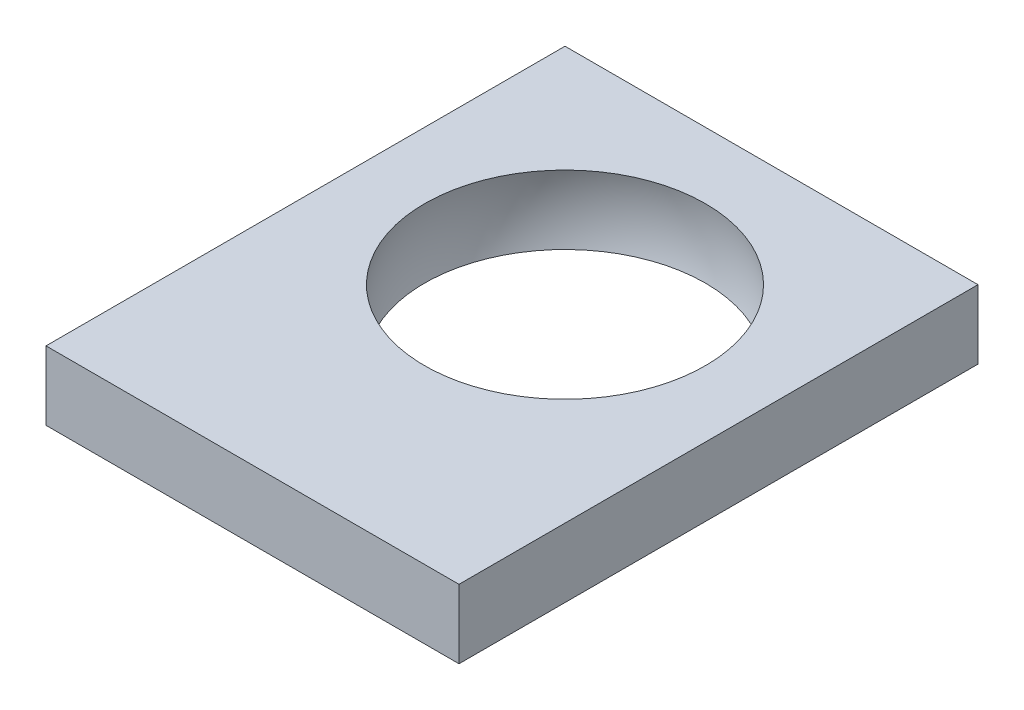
SolidWorks part; units mm, degrees
ref_plane "Plan de face" through (0, 0, 0) normal (0, 0, 1) x (1, 0, 0)
ref_plane "Plan de dessus" through (0, 0, 0) normal (0, 1, 0) x (1, 0, 0)
ref_plane "Plan de droite" through (0, 0, 0) normal (1, 0, 0) x (0, 0, -1)
sketch "Esquisse1" plane through (0, 0, 0) normal (0, 0, 1) x (1, 0, 0)
  line L1 (0, 0) -> (60, 0)
  line L2 (0, 0) -> (0, 10)
  line L3 (0, 10) -> (60, 10)
  line L4 (60, 0) -> (60, 10)
  dimension "D1" = 10
  dimension "D2" = 60
extrude "Boss.-Extru.1" add sketch "Esquisse1" along normal blind 70
ref_plane "Plan1" through (0, 5, 0) normal (0, 1, 0) x (1, 0, 0)
sketch "Esquisse3" plane through (0, 5, 0) normal (0, 1, 0) x (1, 0, 0)
  line L0 (-17.5434, -30) -> (90.4054, -30) construction
  line L1 (30, 4.8874) -> (30, -77.9498) construction
  line L2 (60, 0) -> (0, 0) construction
  line L3 (9, -30) -> (51, -30)
  arc A0 (51, -30) -> (9, -30) centre (30, -30) ccw
  dimension "D2" = 42
  dimension "D1" = 30
revolve "Enlèvement de matière-Révolution1" cut sketch "Esquisse3" angle 360 about L0
sketch "Esquisse4" plane through (0, 0, 70) normal (0, 0, 1) x (1, 0, 0)
  line L1 (60, 0) -> (0, 0)
  line L2 (60, 0) -> (60, 10)
  line L3 (60, 10) -> (0, 10)
  line L4 (0, 0) -> (0, 10)
extrude "Boss.-Extru.2" add sketch "Esquisse4" along normal up to surface (5.4012 mm away)
